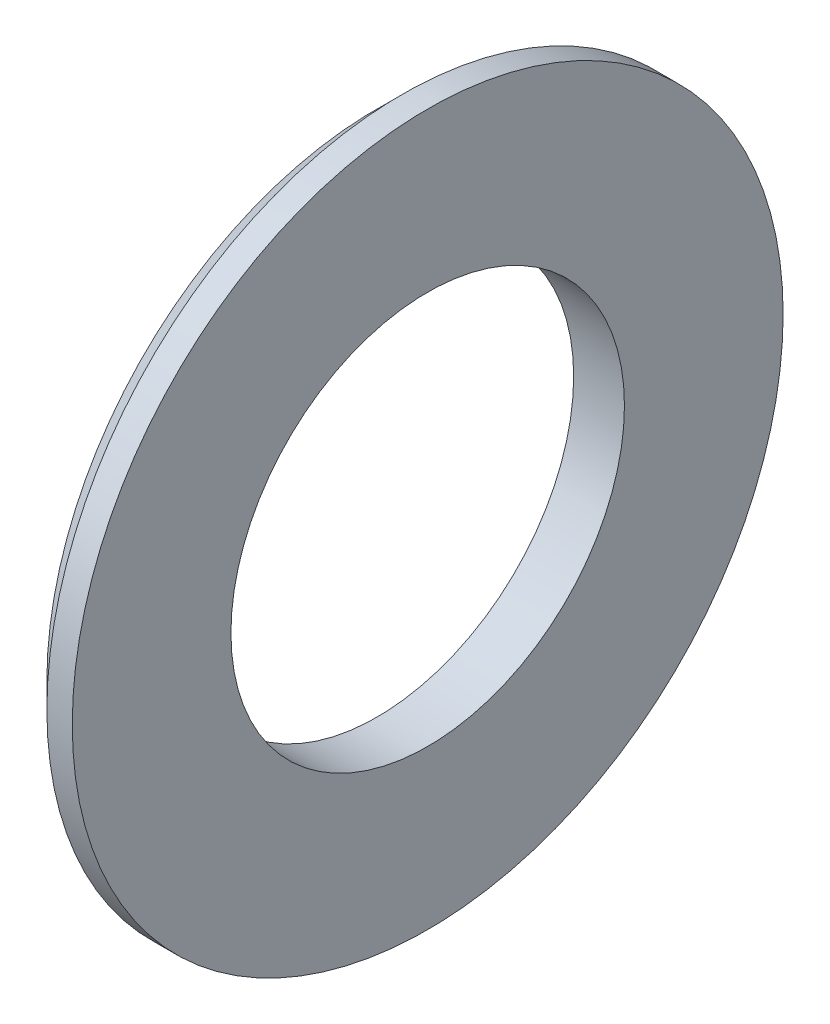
SolidWorks part; units mm, degrees
ref_plane "Plane1" through (0, 0, 0) normal (0, 0, 1) x (1, 0, 0)
ref_plane "Plane2" through (0, 0, 0) normal (0, 1, 0) x (1, 0, 0)
ref_plane "Plane3" through (0, 0, 0) normal (1, 0, 0) x (0, 0, -1)
sketch "Sketch1" plane through (0, 0, 0) normal (0, 0, 1) x (1, 0, 0)
  line L0 (-34.925, 0) -> (9.525, 0) construction
  line L1 (0, 15.5) -> (0, 28)
  line L2 (0, 28) -> (-2, 28)
  line L3 (-4, 26) -> (-4, 15.5)
  line L4 (-4, 15.5) -> (0, 15.5)
  line L5 (-4, 26) -> (-2, 28)
revolve "Base-Revolve" add sketch "Sketch1" angle 360 about L0
equation "\"D3@Sketch1\" = \"Thickness@Sketch1\" * .5"
